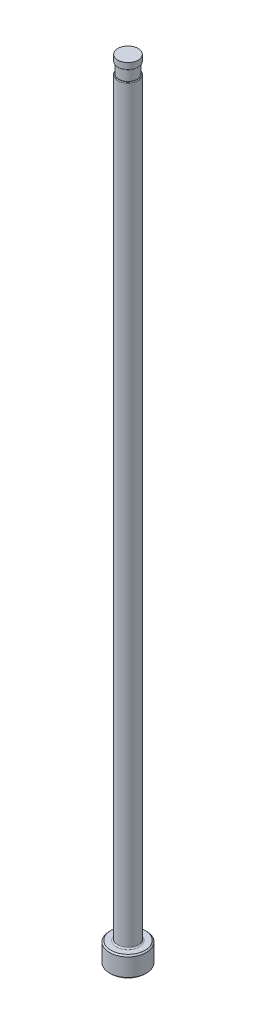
SolidWorks part; units mm, degrees
ref_plane "Front Plane" through (0, 0, 0) normal (0, 0, 1) x (1, 0, 0)
ref_plane "Top Plane" through (0, 0, 0) normal (0, 1, 0) x (1, 0, 0)
ref_plane "Right Plane" through (0, 0, 0) normal (1, 0, 0) x (0, 0, -1)
other "Configuration Table"
sketch "Sketch1" plane through (0, 0, 0) normal (0, 0, 1) x (1, 0, 0)
  line L0 (0, 259.9588) -> (0, -15.1925) construction
  line L1 (0, 0) -> (-3.5687, 0)
  line L2 (-3.5687, 0) -> (-3.5687, 3.9624)
  line L3 (-3.5687, 3.9624) -> (-1.9837, 3.9624)
  line L4 (-1.9837, 3.9624) -> (-1.9837, 152.4)
  line L5 (-1.9837, 152.4) -> (0, 152.4)
  line L6 (0, 152.4) -> (0, 0)
  dimension "L" = 152.4
  dimension "H" = 7.1374
  dimension "T" = 3.9624
  dimension "D" = 3.9675
revolve "Revolve1" add sketch "Sketch1" angle 360 about L0
chamfer "Chamfer1" distance 0.254 angle 45 2 edges at (0, 3.9624, 3.5687) (0, 0, 3.5687)
fillet "Fillet1" radius 0.254 1 edges at (0, 3.9624, 1.9837)
sketch "Sketch2" plane through (0, 0, 0) normal (0, 0, 1) x (1, 0, 0)
  line L0 (-1.9837, 152.4) -> (-1.9837, 4.2164) construction
  line L1 (-1.9837, 151.13) -> (-1.7805, 151.13)
  line L2 (-1.9837, 151.13) -> (-1.9837, 149.098)
  line L3 (-1.9837, 149.098) -> (-1.7805, 149.098)
  line L4 (-1.7805, 151.13) -> (-1.7805, 149.098)
  line L5 (1.9837, 152.4) -> (-1.9837, 152.4) construction
  line L6 (0, 153.4483) -> (0, 147.3282) construction
  dimension "D1" = 2.032
  dimension "N" = 1.27
  dimension "FD" = 0.2032
  dimension "D3" = 3.5611
revolve "Vent Relief" cut sketch "Sketch2" angle 360 about L6
sketch "Sketch3" plane through (0, 0, 0) normal (0, 0, 1) x (1, 0, 0)
  line L0 (-1.7805, 150.114) -> (-1.7805, 86.614)
  line L1 (-1.7805, 151.13) -> (-1.7805, 149.098) construction
  line L2 (-1.9837, 149.098) -> (-1.9837, 4.2164) construction
  line L3 (-1.9837, 85.4964) -> (-1.9837, 150.114)
  line L4 (-1.9837, 150.114) -> (-1.7805, 150.114)
  arc A0 (-1.7805, 86.614) -> (-1.9837, 85.4964) centre (-4.9555, 86.614) cw
  dimension "D1" = 3.175
  dimension "D2" = 63.5
extrude "D-Slot" cut sketch "Sketch3" against normal through all both and the other way through all
sketch "Sketch5" plane through (0, 0, 0) normal (0, 0, 1) x (1, 0, 0)
  line L0 (-1.9837, 151.13) -> (1.9837, 151.13) construction
  line L1 (-1.9837, 152.4) -> (-1.9647, 152.4)
  line L2 (-1.9837, 152.4) -> (-1.9837, 151.13)
  line L3 (-1.9837, 151.13) -> (-1.9647, 151.13)
  line L4 (-1.9647, 152.4) -> (-1.9647, 151.13)
  line L5 (0, 152.6877) -> (0, 150.5771) construction
  dimension "VP" = 0.019
revolve "Vent Diameter" cut sketch "Sketch5" angle 360 about L5
fillet "Fillet2" radius 0.127 2 edges at (1.9837, 149.098, 0) (0, 151.13, 1.9647)
sketch "Pocket Sketch" plane through (0, 0, 0) normal (0, 0, 1) x (1, 0, 0)
  line L0 (-3.9656, 0) -> (-3.9656, 3.9878)
  line L1 (-3.9656, 3.9878) -> (-2.9442, 3.9878)
  line L2 (-2.1822, 4.7498) -> (-2.1822, 22.225)
  line L3 (-2.1822, 22.225) -> (0, 22.225)
  line L4 (0, 22.225) -> (0, 0)
  line L5 (0, 0) -> (-3.9656, 0)
  line L6 (0, 12.6104) -> (0, -2.4989) construction
  line L7 (-3.5687, 3.7084) -> (-3.5687, 0.254) construction
  line L8 (3.3147, 3.9624) -> (-3.3147, 3.9624) construction
  line L9 (-1.9837, 85.4964) -> (-1.9837, 4.2164) construction
  line L10 (-2.9442, 3.9878) -> (-2.1822, 4.7498)
  point P3 (-2.1822, 3.9878)
  dimension "D1" = 7.9311
  dimension "D2" = 0.3969
  dimension "D3" = 0.0254
  dimension "D4" = 0.1984
  dimension "D5" = 4.3644
  dimension "D6" = 22.225
